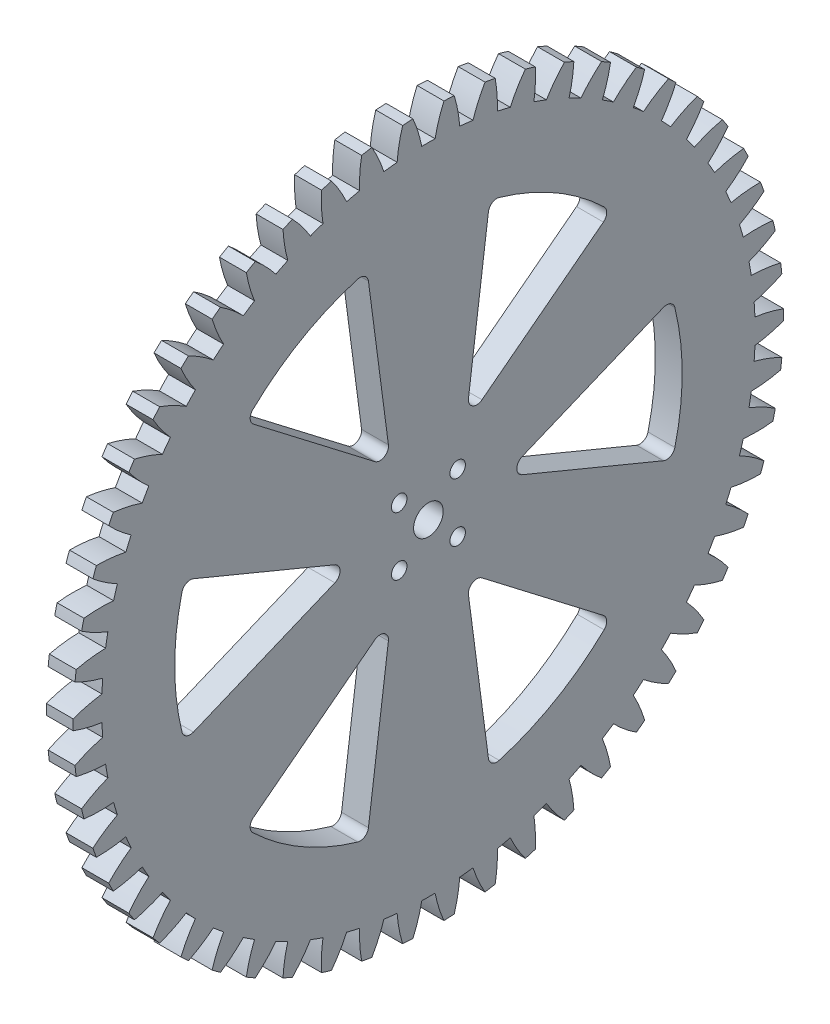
SolidWorks part; units mm, degrees
ref_plane "Plane1" through (0, 0, 0) normal (0, 0, 1) x (1, 0, 0)
ref_plane "Plane2" through (0, 0, 0) normal (0, 1, 0) x (1, 0, 0)
ref_plane "Plane3" through (0, 0, 0) normal (1, 0, 0) x (0, 0, -1)
sketch "HoldingSke" plane through (0, 0, 0) normal (0, 1, 0) x (1, 0, 0)
  line L0 (0, 0) -> (0.1959, -0.2697)
  line L1 (-15, 0) -> (100, 0) construction
  line L2 (0, 0) -> (-2.1039, 2.3779)
  line L3 (0, 0) -> (-11.863, 4.5341)
  line L4 (0, 0) -> (5.0761, 6.9867)
  line L5 (0, 0) -> (-46.8476, -17.4728)
  line L6 (0, 0) -> (-5.2639, -3.5516)
  line L7 (-2.1039, 2.3779) -> (8.6586, 51.2059)
  line L8 (-76.2, 54.61) -> (-75.2, 54.61)
  line L9 (-67.7845, 28.3722) -> (-49.3413, 33.142)
  line L10 (-76.2, 71.12) -> (104.1128, 71.12)
  line L11 (0, 0) -> (-6.35, 0)
  line L12 (-76.2, 101.6) -> (-76.093, 101.6)
  line L13 (24.9733, 27.94) -> (52.9518, 28.4284)
  line L14 (24.9733, 27.94) -> (24.9743, 27.94)
  line L15 (24.9733, 27.94) -> (100.4006, 29.5858)
  line L16 (-63.627, -3) -> (-12.827, -3)
  circle A0 centre (0, 0) radius 3.5
  circle A1 centre (0, 0) radius 37.5
  circle A2 centre (0, 0) radius 37.5
  circle A3 centre (0, 0) radius 3.5
sketch "BasProSke" plane through (0, 0, 0) normal (0, 1, 0) x (1, 0, 0)
  line L0 (-10, 0) -> (60, 0) construction
  line L1 (0, 0) -> (0, 84)
  line L2 (0, 0) -> (6.35, 0)
  line L3 (6.35, 0) -> (6.35, 84)
  line L4 (6.35, 84) -> (0, 84)
revolve "Base-Revolve" add sketch "BasProSke" angle 360 about L0
sketch "TooCutSke" plane through (0, 0, 0) normal (1, 0, 0) x (0, 0, -1)
  line L1 (0, 0) -> (0, 107) construction
  line L2 (0, 0) -> (-2.5431, 80.9601) construction
  line L3 (0, 0) -> (-9.4161, 161.6679) construction
  line L4 (-2.5431, 80.9601) -> (-4.708, 80.834) construction
  arc A0 (1.5754, 77.2329) -> (-1.5754, 77.2329) centre (0, 0) ccw
  arc A1 (3.6761, 83.9449) -> (-3.6761, 83.9449) centre (0, 0) ccw
  circle A2 centre (0, 0) radius 81 construction
  circle A3 centre (0, 0) radius 78.42 construction
  arc A4 (-1.5754, 77.2329) -> (-3.6761, 83.9449) centre (-33.364, 70.9685) ccw
  arc A5 (3.6761, 83.9449) -> (1.5754, 77.2329) centre (33.364, 70.9685) ccw
extrude "ToothCut" cut sketch "TooCutSke" along normal through all
fillet "Breaks" [suppressed] radius 0.06
fillet "RootFillets" [suppressed] radius 0.751
pattern_circular "TeethCuts" count 54 every 6.667 about axis through (-10, 0, 0) along (1, 0, 0) of "ToothCut", "RootFillets", "Breaks"
sketch "HubNeaOneSke" plane through (0, 0, 0) normal (-1, 0, 0) x (0, 0, 1)
  circle A0 centre (0, 0) radius 37.5
extrude "HubNearOne" [suppressed] add sketch "HubNeaOneSke" along normal blind 43.6501
sketch "HubNeaBotSke" plane through (0, 0, 0) normal (-1, 0, 0) x (0, 0, 1)
  circle A0 centre (0, 0) radius 37.5
extrude "HubNearBoth" [suppressed] add sketch "HubNeaBotSke" along normal blind 21.825
ref_plane "FarPln" through (6.35, 0, 0) normal (1, 0, 0) x (0, 0, -1)
sketch "HubFarSke" plane through (6.35, 0, 0) normal (1, 0, 0) x (0, 0, -1)
  circle A0 centre (0, 0) radius 37.5
extrude "HubFar" [suppressed] add sketch "HubFarSke" along normal blind 21.825
sketch "BorSke" plane through (0, 0, 0) normal (1, 0, 0) x (0, 0, -1)
  circle A0 centre (0, 0) radius 3.5
extrude "Bore" cut sketch "BorSke" along normal mid plane 100.0001
sketch "KeySke" plane through (0, 0, 0) normal (1, 0, 0) x (0, 0, -1)
  line L0 (-1, 0) -> (-1, 4.5)
  line L1 (-1, 4.5) -> (1, 4.5)
  line L2 (1, 4.5) -> (1, 0)
  line L3 (0, 0) -> (0, 34) construction
  line L4 (-1, 0) -> (1, 0)
extrude "Keyway" [suppressed] cut sketch "KeySke" along normal mid plane 100.0001
pattern_circular "Keyway2" [suppressed] count 2 every 90 about axis through (-10, 0, 0) along (1, 0, 0)
sketch "Esquisse1" plane through (0, 0, 0) normal (-1, 0, 0) x (0, 0, 1)
  circle A0 centre (6.9148, 6.9148) radius 1.83
  point P2 (6.9148, 6.9148)
  dimension "D1" = 3.66
extrude "Enlèv. mat.-Extru.1" cut sketch "Esquisse1" against normal up to next
pattern_circular "Répétition circulaire1" count 4 every 90 about axis through (0, 0, 0) along (1, 0, 0) of "Enlèv. mat.-Extru.1"
sketch "Esquisse2" plane through (0, 0, 0) normal (-1, 0, 0) x (0, 0, 1)
  line L0 (17.667, 0) -> (57.667, 16.5685)
  line L1 (17.667, 0) -> (57.667, -16.5685)
  line L2 (50, 0) -> (-50, 0) construction
  arc A0 (57.667, -16.5685) -> (57.667, 16.5685) centre (0, 0) ccw
  point P5 (16.15, 0)
  point P7 (11.6683, 0)
  point P10 (50.8815, -40.4484)
  point P11 (60.648, -23.3842)
  dimension "D2" = 120
  dimension "D1" = 40
  dimension "D3" = 45
extrude "Enlèv. mat.-Extru.2" cut sketch "Esquisse2" against normal up to next
fillet "Congé1" radius 2 3 edges at (3.175, 0, 17.667) (3.175, -16.5685, 57.667) (3.175, 16.5685, 57.667)
pattern_circular "Répétition circulaire2" count 6 over 360 about axis through (0, 0, 0) along (1, 0, 0) of "Enlèv. mat.-Extru.2", "Congé1"
equation "' \"Module@HoldingSke\" = 6.35"
equation "' \"Num_teeth@HoldingSke\" = 12"
equation "' \"Ap@HoldingSke\" =  20"
equation "' \"Ap@HoldingSke\" = 20"
equation "' \"Width@HoldingSke\" = 0.5 * 25.4"
equation "' \"Hub_dia@HoldingSke\"= 1 * 25.4"
equation "' \"Hub_dia@HoldingSke\" = 1 * 25.4"
equation "' \"Overall_len@HoldingSke\" = 1.0 * 25.4"
equation "' \"Bore@HoldingSke\" = 0.75 * 25.4"
equation "' \"T_dim@HoldingSke\" = 0.1 * 25.4"
equation "' \"Width@KeySke\" = 0.25 * 25.4"
equation "' \"Show_teeth@HoldingSke\" = 13"
equation "' \"Backlash@HoldingSke\" = 0.009 * 25.4"
equation "' \"Addendum_fac@HoldingSke\" = 1.0"
equation "' \"Dedendum_fac@HoldingSke\" = 1.25"
equation "' \"Dedendum_add@HoldingSke\" = 0.00005 * 25.4"
equation "' \"Clearance_fac@HoldingSke\" = 0.25"
equation "\"Pitch@HoldingSke\" = 1 / \"Module@HoldingSke\""
equation "\"Overcut_dia@TooCutSke\" = (\"Num_teeth@HoldingSke\" + 2 * \"Addendum_fac@HoldingSke\") / \"Pitch@HoldingSke\" + 0.002 * 25.4"
equation "\"Pitch_dia@TooCutSke\" = \"Num_teeth@HoldingSke\" / \"Pitch@HoldingSke\""
equation "\"Base_dia@TooCutSke\" = \"Num_teeth@HoldingSke\" / \"Pitch@HoldingSke\" * cos((\"Ap@HoldingSke\"  * 3.14159265 / 180))"
equation "\"Root_dia@TooCutSke\" = (\"Num_teeth@HoldingSke\" + 2) / \"Pitch@HoldingSke\" - 2 * (\"Addendum_fac@HoldingSke\" + \"Dedendum_fac@HoldingSke\") / \"Pitch@HoldingSke\" - \"Dedendum_add@HoldingSke\" * 2"
equation "\"Half_ang@TooCutSke\" = 180 / \"Num_teeth@HoldingSke\""
equation "\"Half_CT@TooCutSke\" = \"Num_teeth@HoldingSke\" / \"Pitch@HoldingSke\" * sin((3.14159265 / 2 / \"Num_teeth@HoldingSke\")) / 2 - 7 * \"Backlash@HoldingSke\" / 4"
equation "\"Flank_rad@TooCutSke\" = \"Num_teeth@HoldingSke\" / \"Pitch@HoldingSke\" / 5"
equation "\"Radius@RootFillets\" = \"Clearance_fac@HoldingSke\" / \"Pitch@HoldingSke\" + \"Dedendum_add@HoldingSke\""
equation "\"Break_rad@Breaks\" = 0.02 / \"Pitch@HoldingSke\""
equation "\"Thickness@HoldingSke\" = \"Width@HoldingSke\""
equation "\"OAL@HoldingSke\" = \"Thickness@HoldingSke\""
equation "\"MHD@HoldingSke\" = (\"Num_teeth@HoldingSke\" + 2) / \"Pitch@HoldingSke\" - 2 * (\"Addendum_fac@HoldingSke\" + \"Dedendum_fac@HoldingSke\")  / \"Pitch@HoldingSke\" - \"Dedendum_add@HoldingSke\" * 2"
equation "\"MBD@HoldingSke\" = (\"Num_teeth@HoldingSke\" + 2) / \"Pitch@HoldingSke\" - 2 * (\"Addendum_fac@HoldingSke\" + \"Dedendum_fac@HoldingSke\")  / \"Pitch@HoldingSke\" - \"Dedendum_add@HoldingSke\" * 2 - 0.002 * 25.4"
equation "\"MHD@HoldingSke\" = ((sgn( \"MHD@HoldingSke\" - \"Hub_dia@HoldingSke\" )-1)*( \"MHD@HoldingSke\" - \"Hub_dia@HoldingSke\" ))/-2+ \"Hub_dia@HoldingSke\""
equation "\"MBD@HoldingSke\" = ((sgn( \"MBD@HoldingSke\" - \"Bore@HoldingSke\" )-1)*( \"MBD@HoldingSke\" - \"Bore@HoldingSke\" ))/-2+ \"Bore@HoldingSke\""
equation "\"OAL@HoldingSke\" = ((sgn( \"OAL@HoldingSke\" - \"Overall_len@HoldingSke\" )+1)*( \"OAL@HoldingSke\" - \"Overall_len@HoldingSke\" ))/2 + \"Overall_len@HoldingSke\" + 0.000002 * 25.4"
equation "\"Num_teeth@TeethCuts\" = int( \"Show_teeth@HoldingSke\" ) + 1"
equation "\"Num_teeth@TeethCuts\" = ((sgn( \"Num_teeth@TeethCuts\" - \"Num_teeth@HoldingSke\" )-1)*( \"Num_teeth@TeethCuts\" - \"Num_teeth@HoldingSke\" ))/-2+ \"Num_teeth@HoldingSke\""
equation "\"Num_teeth@TeethCuts\" = ((sgn( \"Num_teeth@TeethCuts\" - 2.0)+1)*( \"Num_teeth@TeethCuts\" - 2.0))/2 +2.0"
equation "\"Angle@TeethCuts\" = 360.0 / \"Num_teeth@HoldingSke\""
equation "\"Diameter@BasProSke\" = (\"Num_teeth@HoldingSke\" + 2 * \"Addendum_fac@HoldingSke\") / \"Pitch@HoldingSke\""
equation "\"Thickness@BasProSke\"  = \"Thickness@HoldingSke\""
equation "' \"Fillet_rad@BasProSke\" =  \"Thickness@HoldingSke\" * 0.05"
equation "' \"Fillet_rad@BasProSke\" = \"Thickness@HoldingSke\" * 0.05"
equation "\"MHD@HoldingSke\" = ((sgn( \"MHD@HoldingSke\" - \"Root_dia@TooCutSke\" )-1)*( \"MHD@HoldingSke\" - \"Root_dia@TooCutSke\" ))/-2+ \"Root_dia@TooCutSke\""
equation "\"Diameter@HubNeaOneSke\" = \"MHD@HoldingSke\""
equation "\"Length@HubNearOne\" = \"OAL@HoldingSke\" - \"Thickness@BasProSke\""
equation "\"Diameter@HubNeaBotSke\" = \"MHD@HoldingSke\""
equation "\"Length@HubNearBoth\" = ( \"OAL@HoldingSke\" - \"Thickness@BasProSke\" ) / 2.0"
equation "\"Thickness@FarPln\" = \"Thickness@BasProSke\""
equation "\"Diameter@HubFarSke\" = \"MHD@HoldingSke\""
equation "\"Length@HubFar\" = ( \"OAL@HoldingSke\" - \"Thickness@BasProSke\" ) / 2.0"
equation "\"Diameter@BorSke\" = \"MBD@HoldingSke\""
equation "\"D1@Bore\" = \"OAL@HoldingSke\" * 2.0"
equation "\"D1@Keyway\" = \"OAL@HoldingSke\" * 2.0"
equation "\"Offset@KeySke\" = \"T_dim@HoldingSke\" + \"MBD@HoldingSke\" / 2.0"
